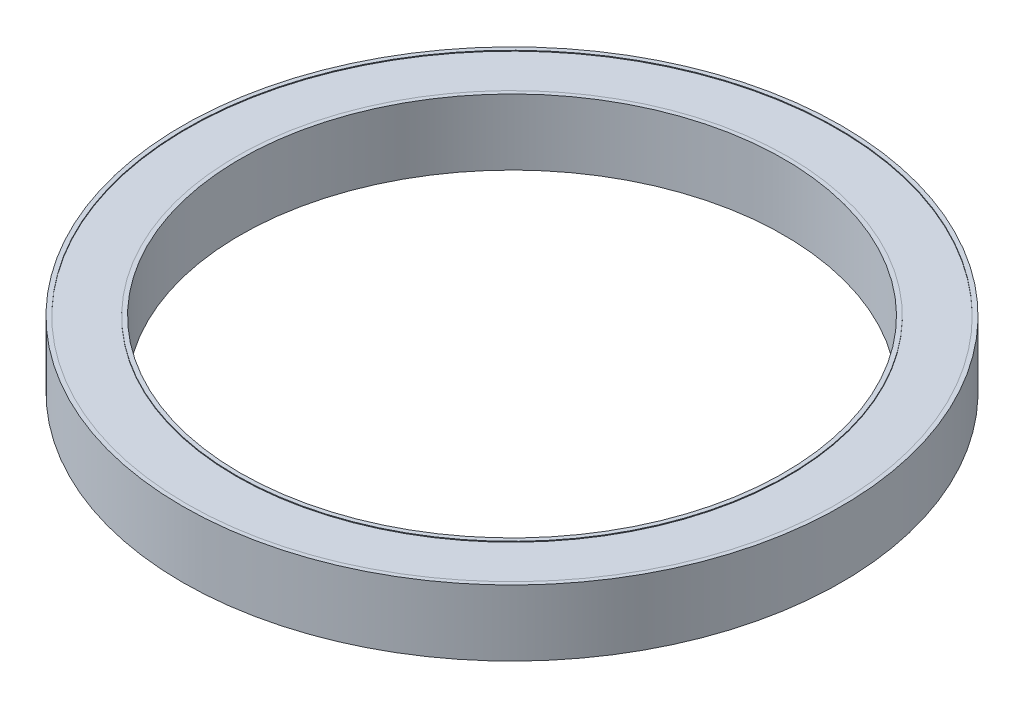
SolidWorks part; units mm, degrees
ref_plane "Alzado" through (0, 0, 0) normal (0, 0, 1) x (1, 0, 0)
ref_plane "Planta" through (0, 0, 0) normal (0, 1, 0) x (1, 0, 0)
ref_plane "Vista lateral" through (0, 0, 0) normal (1, 0, 0) x (0, 0, -1)
sketch "Croquis1" plane through (0, 0, 0) normal (0, 1, 0) x (1, 0, 0)
  circle A0 centre (0, 0) radius 400
  circle A1 centre (0, 0) radius 330
  dimension "D1" = 800
extrude "Saliente-Extruir1" add sketch "Croquis1" along normal blind 80
sketch "Croquis2" plane through (0, 80, 0) normal (0, 1, 0) x (1, 0, 0)
  circle A9 centre (0, 0) radius 395
  circle A10 centre (0, 0) radius 395
  circle A12 centre (0, 0) radius 335
  circle A13 centre (0, 0) radius 335
  dimension "D1" = 5
  dimension "D2" = 5
extrude "Cortar-Extruir1" cut sketch "Croquis2" against normal blind 1
sketch "Croquis3" plane through (0, 0, 0) normal (0, -1, 0) x (1, 0, 0)
  circle A2 centre (0, 0) radius 395
  circle A3 centre (0, 0) radius 395
  circle A5 centre (0, 0) radius 335
  circle A6 centre (0, 0) radius 335
  dimension "D1" = 5
  dimension "D2" = 5
extrude "Cortar-Extruir2" cut sketch "Croquis3" against normal blind 25
